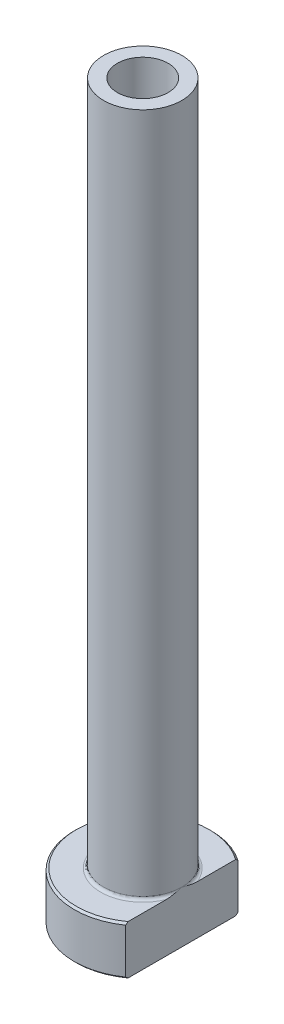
SolidWorks part; units mm, degrees
ref_plane "Front Plane" through (0, 0, 0) normal (0, 0, 1) x (1, 0, 0)
ref_plane "Top Plane" through (0, 0, 0) normal (0, 1, 0) x (1, 0, 0)
ref_plane "Right Plane" through (0, 0, 0) normal (1, 0, 0) x (0, 0, -1)
sketch "Sketch1" plane through (0, 0, 0) normal (0, 0, 1) x (1, 0, 0)
  line L0 (-2.6, 75) -> (-4, 75)
  line L1 (-4, 75) -> (-4, 5)
  line L2 (-4, 5) -> (-7, 5)
  line L3 (-7, 5) -> (-7, 0)
  line L4 (6.05, 0) -> (-6.05, 0) construction
  line L5 (-7, 0) -> (-2.85, 0)
  line L6 (-2.6, 30) -> (-2.6, 75)
  line L7 (0, 92.1877) -> (0, -15.5353) construction
  line L8 (0, -7.7) -> (0, 7.7) construction
  line L9 (-2.6, 30) -> (-2.85, 18)
  line L10 (-2.85, 18) -> (-2.85, 0)
  dimension "D1" = 0.25
  dimension "ID" = 5.2
  dimension "OD" = 8
  dimension "L" = 75
  dimension "H" = 14
  dimension "T" = 5
  dimension "N" = 45
  dimension "D2" = 12
  dimension "L-N" = 30
revolve "Revolve1" add sketch "Sketch1" angle 360 about L7
fillet "Fillet1" radius 0.3 1 edges at (0, 5, 4)
chamfer "Chamfer1" distance 0.2 angle 45 2 edges at (0, 5, 7) (0, 0, 7)
sketch "Sketch2" plane through (0, 0, 0) normal (0, -1, 0) x (1, 0, 0)
  line L0 (4, 5.7446) -> (4, -5.7446)
  circle A0 centre (0, 0) radius 7 construction
  arc A1 (4, 5.7446) -> (4, -5.7446) centre (0, 0) cw
  circle A2 centre (0, 0) radius 4 construction
extrude "Cut-Extrude1" cut sketch "Sketch2" against normal through all
chamfer "Chamfer2" distance 0.5 angle 45 1 edges at (0, 0, 2.85)
